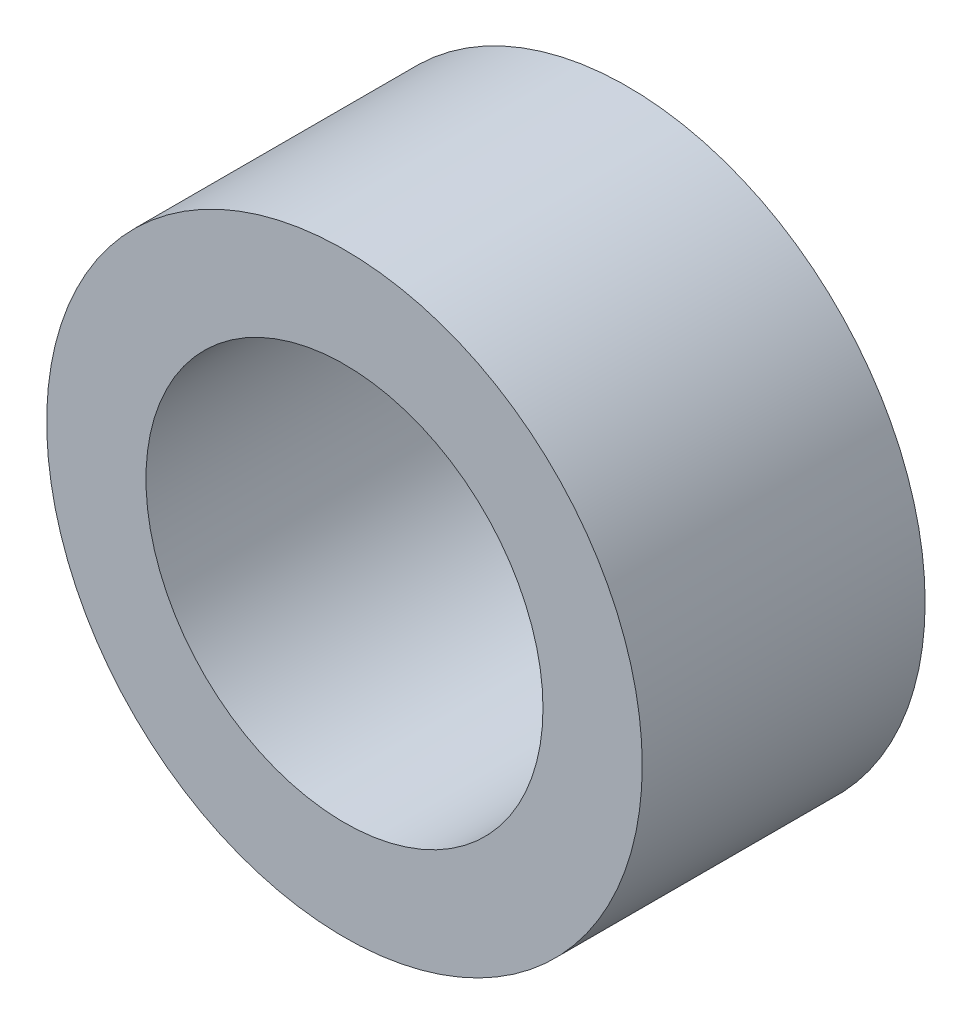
SolidWorks part; units mm, degrees
ref_plane "Front Plane" through (0, 0, 0) normal (0, 0, 1) x (1, 0, 0)
ref_plane "Top Plane" through (0, 0, 0) normal (0, 1, 0) x (1, 0, 0)
ref_plane "Right Plane" through (0, 0, 0) normal (1, 0, 0) x (0, 0, -1)
sketch "Sketch1" plane through (0, 0, 0) normal (0, 1, 0) x (1, 0, 0)
  line L0 (3, 0) -> (2, 0)
  line L1 (2, 0) -> (2, -2.85)
  line L2 (2, -2.85) -> (3, -2.85)
  line L3 (3, -2.85) -> (3, 0)
  line L4 (0, 0) -> (0, -2.85) construction
revolve "Revolve1" add sketch "Sketch1" angle 360 about L4
